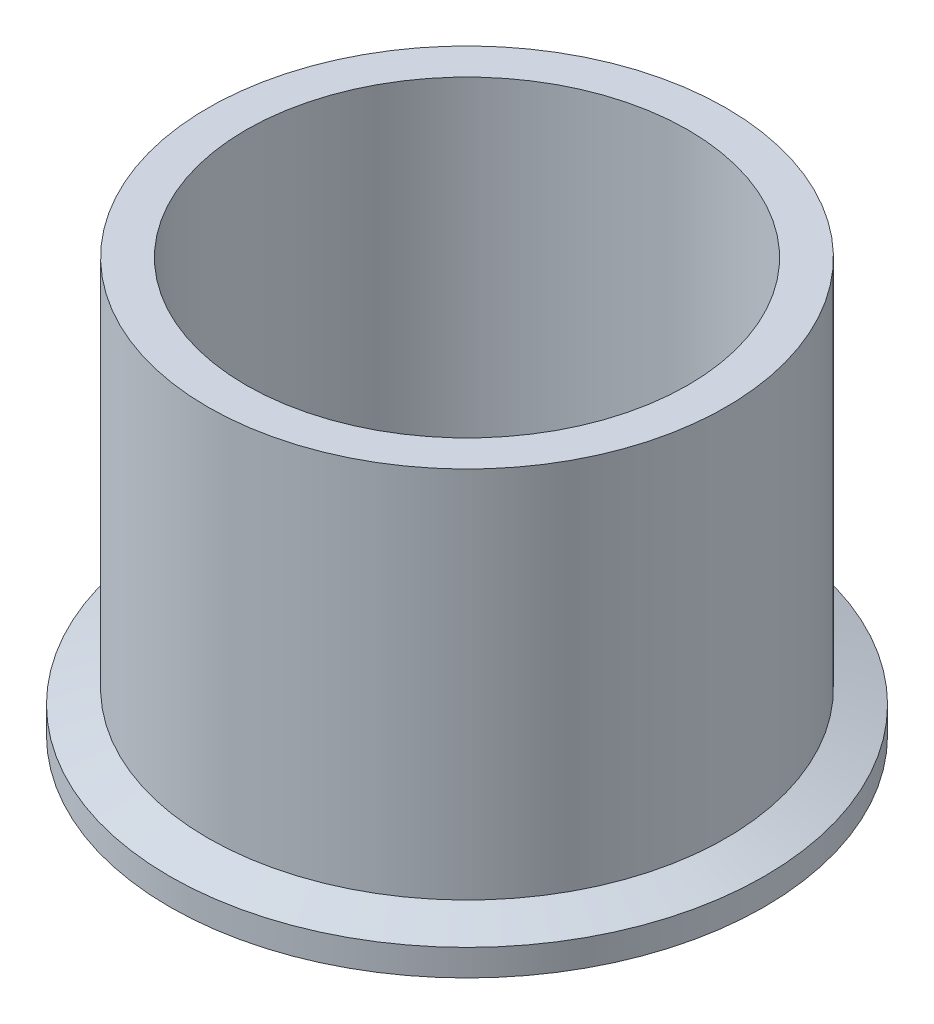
SolidWorks part; units mm, degrees
ref_plane "Front Plane" through (0, 0, 0) normal (0, 0, 1) x (1, 0, 0)
ref_plane "Top Plane" through (0, 0, 0) normal (0, 1, 0) x (1, 0, 0)
ref_plane "Right Plane" through (0, 0, 0) normal (1, 0, 0) x (0, 0, -1)
sketch "Sketch1" plane through (0, 0, 0) normal (0, 0, 1) x (1, 0, 0)
  line L0 (0, 0) -> (0, 44.45) construction
  line L1 (0, 44.45) -> (-27.8384, 44.45)
  line L2 (-27.8384, 44.45) -> (-27.8384, 4.3425)
  line L3 (-27.8384, 4.3425) -> (-31.9532, 2.8448)
  line L4 (-31.9532, 2.8448) -> (-31.9532, 0)
  line L5 (-31.9532, 0) -> (-29.9742, 0)
  line L6 (-26.363, 0) -> (0, 0)
  line L7 (0, 0) -> (0, 44.45)
  line L8 (0, 44.45) -> (-23.749, 44.45)
  line L9 (-23.749, 44.45) -> (-23.749, 0)
  line L10 (-23.749, 0) -> (0, 0)
  line L11 (0, 0) -> (-0.1846, 0.0129)
  line L12 (-29.2675, 0.8729) -> (-29.5066, 0.3095)
  line L13 (-27.0697, 0.8729) -> (-26.8306, 0.3095)
  arc A0 (-29.2675, 0.8729) -> (-27.0697, 0.8729) centre (-28.1686, 0.4064) cw
  arc A1 (-26.363, 0) -> (-26.8306, 0.3095) centre (-26.363, 0.508) cw
  arc A2 (-29.9742, 0) -> (-29.5066, 0.3095) centre (-29.9742, 0.508) ccw
  point P12 (-27.0461, 0)
  dimension "D6" = 1.1938
  dimension "D7" = 0.508
  dimension "D1" = 27.8384
  dimension "D3" = 31.9532
  dimension "D4" = 70
  dimension "D5" = 28.1686
  dimension "D8" = 4.0894
  dimension "D9" = 44.45
  dimension "D10" = 0.4064
  dimension "D11" = 2.8448
revolve "Revolve2" add sketch "Sketch1" angle 360 about L0
